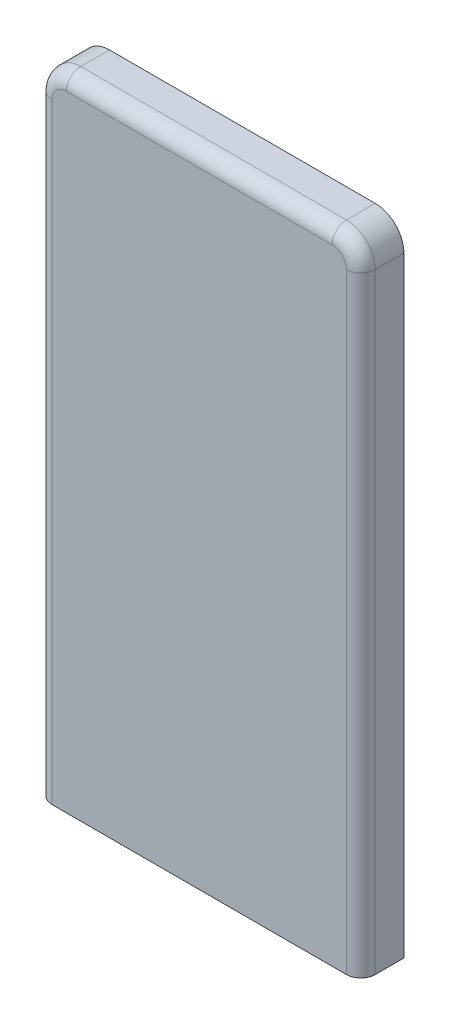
SolidWorks part; units mm, degrees
ref_plane "Plane1" through (0, 0, 0) normal (0, 0, 1) x (1, 0, 0)
ref_plane "Plane2" through (0, 0, 0) normal (0, 1, 0) x (1, 0, 0)
ref_plane "Plane3" through (0, 0, 0) normal (1, 0, 0) x (0, 0, -1)
sketch "Sketch1" plane through (0, 0, 0) normal (0, 0, 1) x (1, 0, 0)
  line L1 (-112.5, 143.5) -> (112.5, 143.5)
  line L2 (-112.5, 143.5) -> (-112.5, -301.5)
  line L3 (-112.5, -301.5) -> (112.5, -301.5)
  line L4 (112.5, 143.5) -> (112.5, -301.5)
  line L8 (0, 143.5) -> (0, -301.5) construction
  line L9 (0, -50) -> (0, 50) construction
  line L10 (50, 0) -> (-50, 0) construction
  dimension "D1" = 225
  dimension "D2" = 143.5
  dimension "D5" = 445
extrude "Base-Extrude" add sketch "Sketch1" against normal blind 30
fillet "Fillet1" radius 20 2 edges at (-112.5, 143.5, -15) (112.5, 143.5, -15)
fillet "Fillet2" radius 10 5 edges at (-112.5, -89, 0) (0, 143.5, 0) (-106.6421, 137.6421, 0) (106.6421, 137.6421, 0) (112.5, -89, 0)
shell "Shell1" thickness 2
